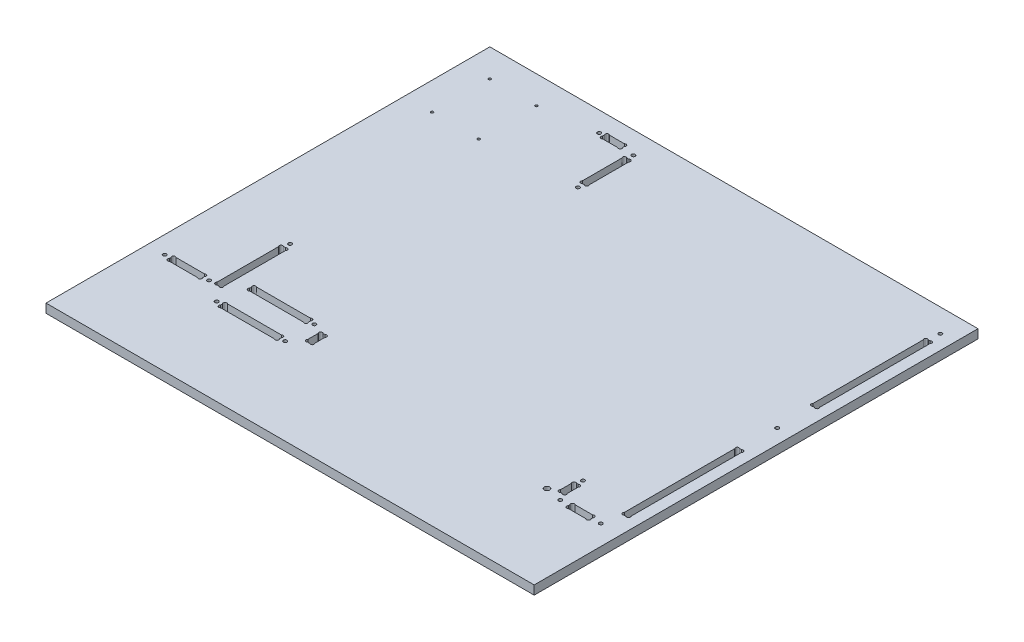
SolidWorks part; units mm, degrees
ref_plane "Plan de face" through (0, 0, 0) normal (0, 0, 1) x (1, 0, 0)
ref_plane "Plan de dessus" through (0, 0, 0) normal (0, 1, 0) x (1, 0, 0)
ref_plane "Plan de droite" through (0, 0, 0) normal (1, 0, 0) x (0, 0, -1)
sketch "Esquisse1" plane through (0, 0, 0) normal (0, 1, 0) x (1, 0, 0)
  line L0 (-19.5516, 0) -> (557.8293, 0) construction
  line L1 (-5, -31.2094) -> (-5, 475.6783) construction
  line L2 (435, -31.2094) -> (435, 475.6783) construction
  line L3 (-19.5516, 400) -> (557.8293, 400) construction
  line L4 (140.0509, 107.4) -> (380.5, 107.4) construction
  line L5 (-5, 0) -> (435, 0)
  line L6 (425, 419.7304) -> (425, 43.9437) construction
  line L7 (419, 446.9539) -> (419, 88.7373) construction
  line L8 (526.1178, 389) -> (404.7627, 389) construction
  line L9 (-5, 0) -> (-5, 400)
  line L10 (-5, 400) -> (435, 400)
  line L11 (435, 0) -> (435, 400)
  line L12 (378.5, 120.7147) -> (378.5, 43.9437) construction
  line L13 (378.1149, 78) -> (401.061, 78) construction
  line L14 (398.75, 64.3264) -> (398.75, 88.7373) construction
  line L15 (409, 64.3264) -> (409, 82.8975) construction
  line L16 (348.7368, 91.2) -> (380.5, 91.2) construction
  line L17 (380.5, 79.8686) -> (380.5, 68.0411) construction
  line L18 (409, 81) -> (398.9818, 70.9818) construction
  line L20 (380.5, 98.4) -> (358.3032, 98.4) construction
  line L21 (375.5, 112.2906) -> (375.5, 101.2) construction
  line L22 (367.6185, 102.9) -> (377.0318, 102.9) construction
  line L23 (378.5, 98.4) -> (370.8582, 90.7582) construction
  line L24 (409, 78.7373) -> (409, 77.2627)
  line L25 (406.7373, 81) -> (390.7627, 81)
  line L26 (372.5, -31.2094) -> (372.5, 120.7147) construction
  line L27 (388.5, 78.7373) -> (388.5, 77.2627)
  line L28 (390.7627, 75) -> (406.7373, 75)
  line L29 (404.7627, 232) -> (505.736, 232) construction
  line L30 (404.7627, 369) -> (474.0389, 369) construction
  line L31 (404.7627, 267) -> (474.0389, 267) construction
  line L32 (404.7627, 317) -> (454.0379, 317) construction
  line L33 (422, 394.8553) -> (422, 227.8825) construction
  line L34 (352.2159, 75) -> (522.8397, 75) construction
  line L35 (370.2664, 81) -> (487.982, 81) construction
  line L36 (404.7627, 379) -> (454.0379, 379) construction
  line L37 (419, 369) -> (446.0492, 341.9508) construction
  line L38 (421.2627, 265) -> (422.7373, 265)
  line L39 (421.2627, 369) -> (422.7373, 369)
  line L40 (419, 366.7373) -> (419, 267.2627)
  line L41 (425, 267.2627) -> (425, 366.7373)
  line L42 (425, 196.7373) -> (425, 97.2627)
  line L43 (419, 97.2627) -> (419, 196.7373)
  line L44 (421.2627, 95) -> (422.7373, 95)
  line L45 (421.2627, 199) -> (422.7373, 199)
  line L47 (374.7627, 84) -> (376.2373, 84)
  line L48 (378.5, 86.2627) -> (378.5, 96.1373)
  line L49 (376.2373, 98.4) -> (374.7627, 98.4)
  line L50 (372.5, 96.1373) -> (372.5, 86.2627)
  line L122 (117.7627, 385) -> (131.2373, 385)
  line L123 (115.5, 381.2627) -> (115.5, 382.7373)
  line L124 (131.2373, 379) -> (117.7627, 379)
  line L125 (133.5, 382.7373) -> (133.5, 381.2627)
  line L126 (147.5, 337.2627) -> (147.5, 372.7373)
  line L127 (143.5627, 335) -> (145.2373, 335)
  line L128 (141.3, 372.7373) -> (141.3, 337.2627)
  line L129 (145.2373, 375) -> (143.5627, 375)
  line L130 (43.4873, 94.2) -> (18.0127, 94.2)
  line L131 (45.75, 90.4627) -> (45.75, 91.9373)
  line L132 (18.0127, 88.2) -> (43.4873, 88.2)
  line L139 (15.75, 91.9373) -> (15.75, 90.4627)
  line L140 (55.75, 93.4627) -> (55.75, 148.9373)
  line L141 (59.6873, 91.2) -> (58.0127, 91.2)
  line L142 (61.95, 148.9373) -> (61.95, 93.4627)
  line L143 (59.6873, 151.2) -> (58.0127, 151.2)
  line L144 (75.15, 103.4627) -> (75.15, 105.1373)
  line L145 (77.4127, 107.4) -> (125.8373, 107.4)
  line L146 (128.1, 105.1373) -> (128.1, 103.4627)
  line L147 (125.8373, 101.2) -> (77.4127, 101.2)
  line L148 (125.8373, 81.2) -> (77.4127, 81.2)
  line L149 (128.1, 77.2627) -> (128.1, 78.9373)
  line L150 (77.4127, 75) -> (125.8373, 75)
  line L151 (75.15, 78.9373) -> (75.15, 77.2627)
  line L152 (145.2373, 101.2) -> (143.5627, 101.2)
  line L153 (147.5, 89.6627) -> (147.5, 98.9373)
  line L154 (143.5627, 87.4) -> (145.2373, 87.4)
  line L155 (141.3, 98.9373) -> (141.3, 89.6627)
  line L156 (365.5, 84.7332) -> (365.5, 69.0389) construction
  line L157 (353.291, 81) -> (368.759, 81) construction
  line L165 (7.5196, 323) -> (89.5795, 323) construction
  line L166 (20, 383.8686) -> (20, 314.8461) construction
  line L167 (62, 383.8686) -> (62, 314.8461) construction
  line L181 (36.6961, 323) -> (92.9744, 323) construction
  circle A0 centre (417, 78) radius 1.6
  arc A1 (409, 78.7373) -> (406.7373, 81) centre (407.8686, 79.8686) ccw
  circle A2 centre (375.5, 103.4) radius 1.6
  arc A3 (378.5, 96.1373) -> (376.2373, 98.4) centre (377.3686, 97.2686) ccw
  arc A4 (372.5, 96.1373) -> (374.7627, 98.4) centre (373.6314, 97.2686) cw
  arc A5 (409, 77.2627) -> (406.7373, 75) centre (407.8686, 76.1314) cw
  arc A6 (388.5, 78.7373) -> (390.7627, 81) centre (389.6314, 79.8686) cw
  arc A7 (388.5, 77.2627) -> (390.7627, 75) centre (389.6314, 76.1314) ccw
  circle A8 centre (380.5, 78) radius 1.6
  circle A9 centre (422, 379) radius 1.6
  arc A10 (421.2627, 369) -> (419, 366.7373) centre (420.1314, 367.8686) ccw
  arc A11 (422.7373, 369) -> (425, 366.7373) centre (423.8686, 367.8686) cw
  arc A12 (422.7373, 265) -> (425, 267.2627) centre (423.8686, 266.1314) ccw
  arc A13 (421.2627, 265) -> (419, 267.2627) centre (420.1314, 266.1314) cw
  circle A14 centre (422, 232) radius 1.6
  arc A16 (421.2627, 199) -> (419, 196.7373) centre (420.1314, 197.8686) ccw
  arc A17 (422.7373, 199) -> (425, 196.7373) centre (423.8686, 197.8686) cw
  arc A18 (422.7373, 95) -> (425, 97.2627) centre (423.8686, 96.1314) ccw
  arc A19 (421.2627, 95) -> (419, 97.2627) centre (420.1314, 96.1314) cw
  arc A20 (378.5, 86.2627) -> (376.2373, 84) centre (377.3686, 85.1314) cw
  arc A21 (372.5, 86.2627) -> (374.7627, 84) centre (373.6314, 85.1314) ccw
  arc A47 (115.5, 381.2627) -> (117.7627, 379) centre (116.6314, 380.1314) ccw
  arc A48 (115.5, 382.7373) -> (117.7627, 385) centre (116.6314, 383.8686) cw
  arc A49 (133.5, 382.7373) -> (131.2373, 385) centre (132.3686, 383.8686) ccw
  arc A50 (133.5, 381.2627) -> (131.2373, 379) centre (132.3686, 380.1314) cw
  circle A51 centre (111.5, 382) radius 1.6
  arc A63 (143.5627, 335) -> (141.3, 337.2627) centre (142.4314, 336.1314) cw
  arc A64 (145.2373, 335) -> (147.5, 337.2627) centre (146.3686, 336.1314) ccw
  circle A65 centre (144.4, 330) radius 1.6
  arc A66 (143.5627, 375) -> (141.3, 372.7373) centre (142.4314, 373.8686) ccw
  arc A67 (145.2373, 375) -> (147.5, 372.7373) centre (146.3686, 373.8686) cw
  circle A68 centre (144.4, 380) radius 1.6
  circle A69 centre (10.75, 91.2) radius 1.6
  arc A70 (15.75, 90.4627) -> (18.0127, 88.2) centre (16.8814, 89.3314) ccw
  arc A71 (15.75, 91.9373) -> (18.0127, 94.2) centre (16.8814, 93.0686) cw
  arc A72 (45.75, 91.9373) -> (43.4873, 94.2) centre (44.6186, 93.0686) ccw
  arc A73 (45.75, 90.4627) -> (43.4873, 88.2) centre (44.6186, 89.3314) cw
  circle A81 centre (50.75, 91.2) radius 1.6
  circle A82 centre (58.85, 156.2) radius 1.6
  arc A83 (58.0127, 91.2) -> (55.75, 93.4627) centre (56.8814, 92.3314) cw
  arc A84 (59.6873, 91.2) -> (61.95, 93.4627) centre (60.8186, 92.3314) ccw
  arc A85 (58.0127, 151.2) -> (55.75, 148.9373) centre (56.8814, 150.0686) ccw
  arc A86 (59.6873, 151.2) -> (61.95, 148.9373) centre (60.8186, 150.0686) cw
  circle A87 centre (132.5, 104.3) radius 1.6
  arc A88 (128.1, 105.1373) -> (125.8373, 107.4) centre (126.9686, 106.2686) ccw
  arc A89 (128.1, 103.4627) -> (125.8373, 101.2) centre (126.9686, 102.3314) cw
  arc A90 (75.15, 103.4627) -> (77.4127, 101.2) centre (76.2814, 102.3314) ccw
  arc A91 (75.15, 105.1373) -> (77.4127, 107.4) centre (76.2814, 106.2686) cw
  circle A92 centre (70.75, 78.1) radius 1.6
  circle A93 centre (132.5, 78.1) radius 1.6
  arc A94 (75.15, 77.2627) -> (77.4127, 75) centre (76.2814, 76.1314) ccw
  arc A95 (75.15, 78.9373) -> (77.4127, 81.2) centre (76.2814, 80.0686) cw
  arc A96 (128.1, 78.9373) -> (125.8373, 81.2) centre (126.9686, 80.0686) ccw
  arc A97 (128.1, 77.2627) -> (125.8373, 75) centre (126.9686, 76.1314) cw
  arc A98 (145.2373, 101.2) -> (147.5, 98.9373) centre (146.3686, 100.0686) cw
  arc A99 (143.5627, 101.2) -> (141.3, 98.9373) centre (142.4314, 100.0686) ccw
  arc A100 (145.2373, 87.4) -> (147.5, 89.6627) centre (146.3686, 88.5314) ccw
  arc A101 (143.5627, 87.4) -> (141.3, 89.6627) centre (142.4314, 88.5314) cw
  circle A102 centre (365.5, 81) radius 2.45
  circle A105 centre (20, 375) radius 1.1
  circle A106 centre (62, 375) radius 1.1
  circle A107 centre (62, 323) radius 1.1
  circle A108 centre (20, 323) radius 1.1
  dimension "D12" = 62.5
  dimension "D23" = 35
  dimension "D29" = 9
  dimension "D65" = 6
  dimension "D8" = 6
  dimension "D21" = 157
  dimension "D30" = 4.5
  dimension "D3" = 400
  dimension "D5" = 440
  dimension "D9" = 10
  dimension "D10" = 16
  dimension "D11" = 314
  dimension "D13" = 6
  dimension "D14" = 3
  dimension "D15" = 26.25
  dimension "D16" = 10.25
  dimension "D17" = 16.2
  dimension "D18" = 8
  dimension "D20" = 45
  dimension "D22" = 20
  dimension "D24" = 50
  dimension "D25" = 10
  dimension "D26" = 75
  dimension "D27" = 3
  dimension "D28" = 45
  dimension "D31" = 3
  dimension "D32" = 45
  dimension "D62" = 7
  dimension "D71" = 42
  dimension "D72" = 25
extrude "Boss.-Extru.1" add sketch "Esquisse1" along normal blind 8
